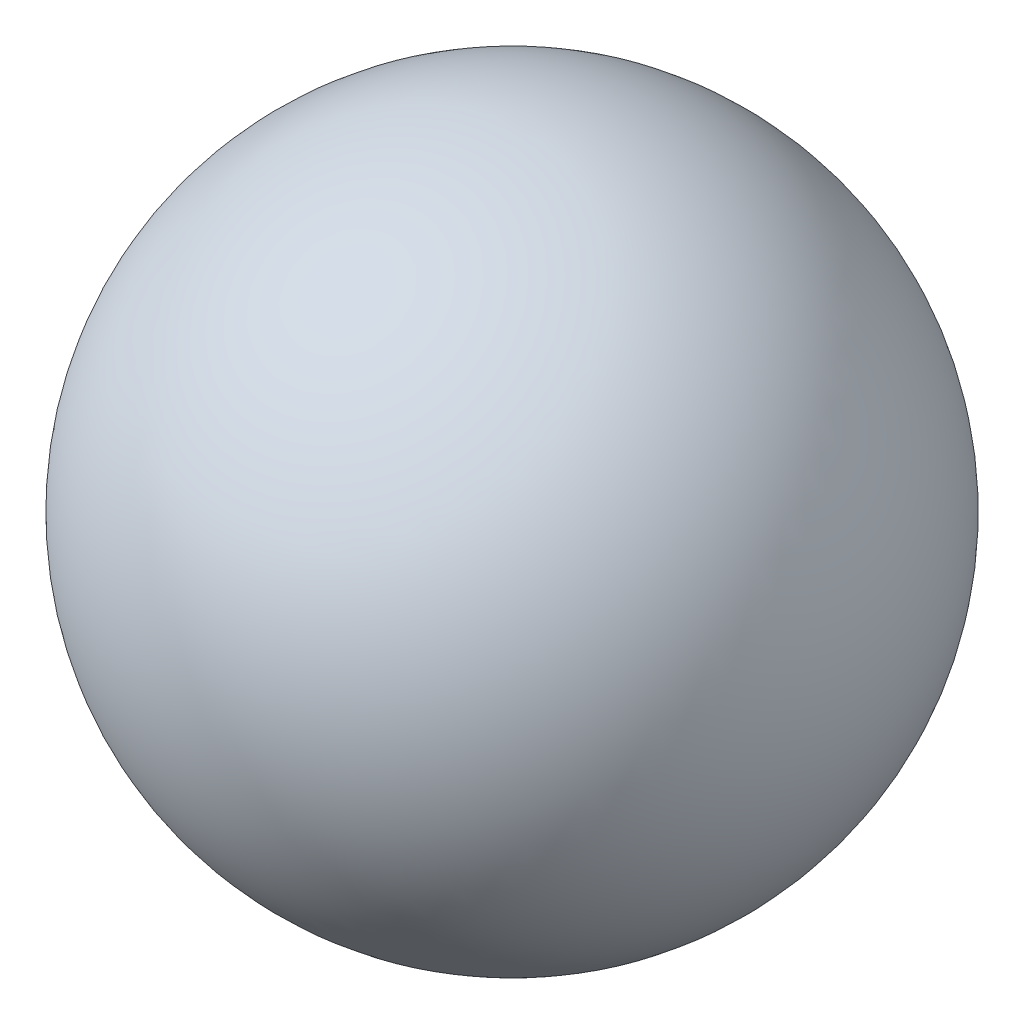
SolidWorks part; units mm, degrees
ref_plane "Front Plane" through (0, 0, 0) normal (0, 0, 1) x (1, 0, 0)
ref_plane "Top Plane" through (0, 0, 0) normal (0, 1, 0) x (1, 0, 0)
ref_plane "Right Plane" through (0, 0, 0) normal (1, 0, 0) x (0, 0, -1)
sketch "Sketch1" plane through (0, 0, 0) normal (0, 0, 1) x (1, 0, 0)
  line L0 (0, 3.1242) -> (0, -3.1242)
  arc A0 (0, -3.1242) -> (0, 3.1242) centre (0, 0) ccw
  dimension "D1" = 3.1242
revolve "Revolve1" add sketch "Sketch1" angle 360 about L0
